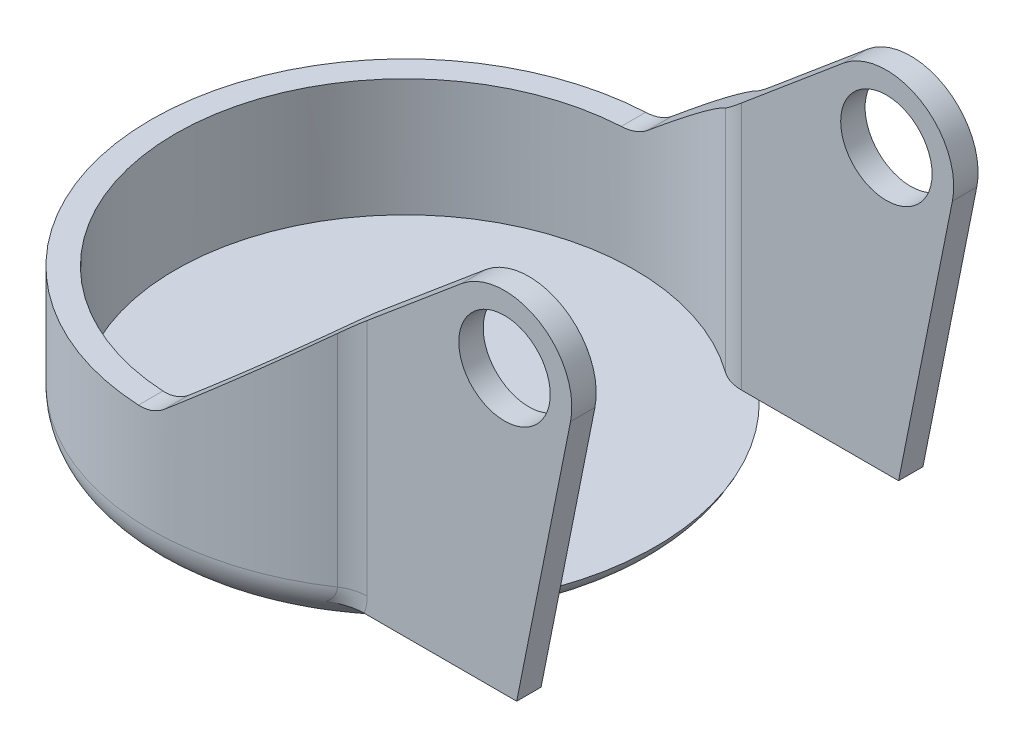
SolidWorks part; units mm, degrees
ref_plane "Ebene vorne" through (0, 0, 0) normal (0, 0, 1) x (1, 0, 0)
ref_plane "Ebene oben" through (0, 0, 0) normal (0, 1, 0) x (1, 0, 0)
ref_plane "Ebene rechts" through (0, 0, 0) normal (1, 0, 0) x (0, 0, -1)
sketch "Skizze1" plane through (0, 0, 0) normal (0, 1, 0) x (1, 0, 0)
  circle A0 centre (0, 0) radius 12.5
  dimension "D1" = 25
extrude "Aufsatz-Linear austragen1" add sketch "Skizze1" along normal blind 1.2
sketch "Skizze2" plane through (0, 1.2, 0) normal (0, 1, 0) x (1, 0, 0)
  line L0 (7.5, 10) -> (15.5, 10)
  line L1 (7.5, -10) -> (15.5, -10)
  line L2 (-1.0558, 0) -> (22.5402, 0) construction
  line L3 (7.0887, 8.8) -> (15.5, 8.8)
  line L4 (8.6648, -8.8) -> (15.5, -8.8)
  line L5 (15.5, 10) -> (15.5, 8.8)
  line L6 (15.5, -8.8) -> (15.5, -10)
  line L7 (8.6648, -8.8) -> (7.0887, -8.8)
  arc A0 (7.5, 10) -> (7.5, -10) centre (0, 0) ccw
  arc A1 (7.0887, 8.8) -> (7.0887, -8.8) centre (0, 0) ccw
  dimension "D1" = 25
  dimension "D2" = 22.6
  dimension "D5" = 15.5
  dimension "D3" = 20
  dimension "D4" = 17.6
extrude "Aufsatz-Linear austragen2" add sketch "Skizze2" along normal blind 20
sketch "Skizze4" plane through (0, 0, 10) normal (0, 0, 1) x (1, 0, 0)
  line L0 (15.5, 1.2) -> (19.5, 21.2)
  line L1 (19.5, 21.2) -> (15.5, 21.2)
  line L2 (15.5, 21.2) -> (15.5, 1.2)
  line L3 (-12.5, 21.2) -> (-12.5, 0) construction
  dimension "D1" = 32
extrude "Aufsatz-Linear austragen3" add sketch "Skizze4" against normal up to surface (1.2 mm away)
sketch "Skizze5" plane through (0, 0, -10) normal (0, 0, -1) x (-1, 0, 0)
  line L0 (-15.5, 1.2) -> (-19.5, 21.2)
  line L1 (-19.5, 21.2) -> (-15.5, 21.2)
  line L2 (-15.5, 21.2) -> (-15.5, 1.2)
extrude "Aufsatz-Linear austragen4" add sketch "Skizze5" against normal up to surface (1.2 mm away)
sketch "Skizze3" plane through (0, 0, 0) normal (0, 0, 1) x (1, 0, 0)
  line L0 (-12.5, 7) -> (0.0906, 7)
  line L1 (-12.5, 21.2) -> (-12.5, 0) construction
  line L2 (0.0906, 7) -> (12.7696, 17.6389)
  line L4 (19.5, 21.2) -> (-12.5, 21.2)
  line L5 (-12.5, 21.2) -> (-12.5, 7)
  line L8 (-12.5, 0) -> (12.5, 0) construction
  line L9 (15.5, 1.2) -> (19.5, 21.2) construction
  line L10 (19.5, 21.2) -> (18.15, 14.45)
  circle A0 centre (14.9, 15.1) radius 2.25
  arc A1 (18.15, 14.45) -> (12.7696, 17.6389) centre (14.9, 15.1) ccw
  dimension "D3" = 4.5
  dimension "D1" = 7
  dimension "D2" = 140
  dimension "D4" = 15.1
  dimension "D5" = 14.9
extrude "Schnitt-Linear austragen1" cut sketch "Skizze3" against normal mid plane 30
fillet "Verrundung2" radius 2 1 edges at (0, 0, 12.5)
fillet "Verrundung3" radius 2 8 edges at (7.4323, 1.5997, -10) (7.4169, 1.557, 10) (0.0906, 7, 11.8997) (0.0906, 7, -11.8997) (7.0887, 7.0361, 8.8) (7.0887, 7.0361, -8.8) (7.5, 7.6086, -10) (7.5, 7.6086, 10)
sketch "Skizze7" plane through (0, 0, 0) normal (0, -1, 0) x (1, 0, 0)
  circle A0 centre (0, 0) radius 2.5
  dimension "D1" = 5
extrude "Schnitt-Linear austragen2" cut sketch "Skizze7" against normal through all
